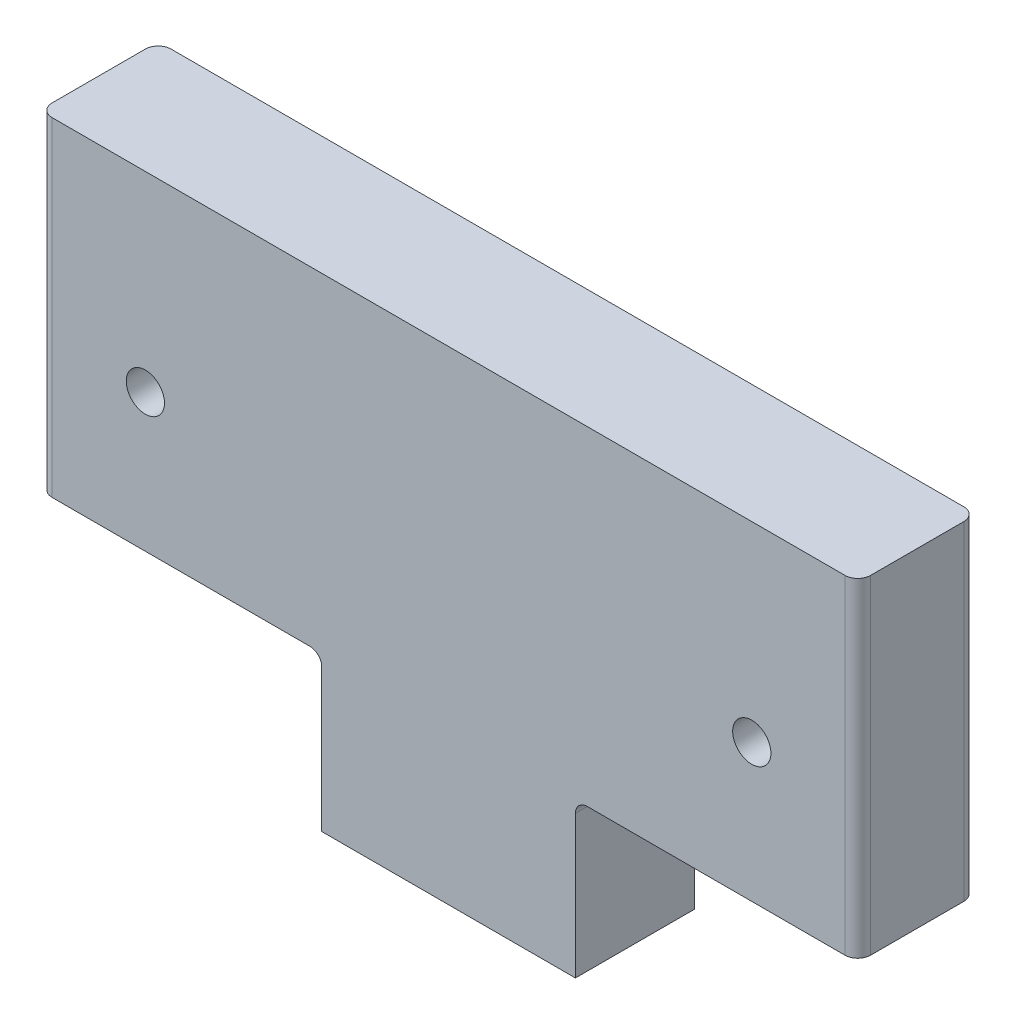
SolidWorks part; units mm, degrees
ref_plane "Front Plane" through (0, 0, 0) normal (0, 0, 1) x (1, 0, 0)
ref_plane "Top Plane" through (0, 0, 0) normal (0, 1, 0) x (1, 0, 0)
ref_plane "Right Plane" through (0, 0, 0) normal (1, 0, 0) x (0, 0, -1)
sketch "Sketch1" plane through (0, 0, 0) normal (0, 0, 1) x (1, 0, 0)
  line L1 (-54.6608, 21.971) -> (54.6608, 21.971)
  line L2 (-54.6608, 21.971) -> (-54.6608, -21.971)
  line L3 (-54.6608, -21.971) -> (54.6608, -21.971)
  line L4 (54.6608, 21.971) -> (54.6608, -21.971)
  line L5 (-54.6608, 21.971) -> (54.6608, -21.971) construction
  line L6 (-54.6608, -21.971) -> (54.6608, 21.971) construction
  line L8 (54.7878, 21.844) -> (54.7878, -21.971) construction
  point P0 (0, 0)
  dimension "D1" = 43.942
  dimension "D2" = 0.127
extrude "Boss-Extrude1" add sketch "Sketch1" along normal mid plane 15.875
hole_wizard "1/4-20 Tapped Hole1" positions "Sketch4" profile "Sketch5" tap size "1/4-20" standard "ANSI Inch"
sketch "Sketch4" plane through (0, 0, 7.9375) normal (0, 0, 1) x (1, 0, 0)
  line L0 (0, 21.971) -> (0, 35.7719) construction
  line L1 (54.6608, 21.971) -> (-54.6608, 21.971) construction
  point P0 (-40.5003, -3.556)
  point P10 (40.5003, -3.556)
sketch "Sketch5" plane through (-40.5003, -3.556, 7.9375) normal (1, 0, 0) x (0, -1, 0)
  line L0 (0, 0) -> (0, 15.875)
  line L1 (0, 15.875) -> (2.5527, 15.875)
  line L2 (2.5527, 15.875) -> (2.5527, 0)
  line L5 (2.5527, 0) -> (0, 0)
  line L11 (0, -6.35) -> (0, 107.95) construction
  dimension "Thru Tap Drill Dia." = 5.1054
  dimension "Thru Tap Drill Depth" = 15.875
sketch "Sketch6" plane through (0, 0, 7.9375) normal (0, 0, 1) x (1, 0, 0)
  line L0 (-54.6608, -21.971) -> (54.6608, -21.971) construction
  line L1 (-16.9418, -21.971) -> (16.9418, -21.971)
  line L2 (-16.9418, -21.971) -> (-16.9418, -42.6085)
  line L3 (-16.9418, -42.6085) -> (16.9418, -42.6085)
  line L4 (16.9418, -21.971) -> (16.9418, -42.6085)
  line L8 (-54.6608, 21.971) -> (-54.6608, -21.971) construction
  line L9 (0, -42.6085) -> (0, 21.971) construction
  line L10 (54.6608, 21.971) -> (-54.6608, 21.971) construction
  dimension "D1" = 37.719
  dimension "D2" = 20.6375
extrude "Boss-Extrude2" add sketch "Sketch6" against normal up to surface (15.875 mm away)
fillet "Fillet1" radius 1.7145 4 edges at (-54.6608, 0, -7.9375) (-54.6608, 0, 7.9375) (54.6608, 0, -7.9375) (54.6608, 0, 7.9375)
fillet "Fillet2" radius 1.5875 2 edges at (-16.9418, -21.971, 0) (16.9418, -21.971, 0)
